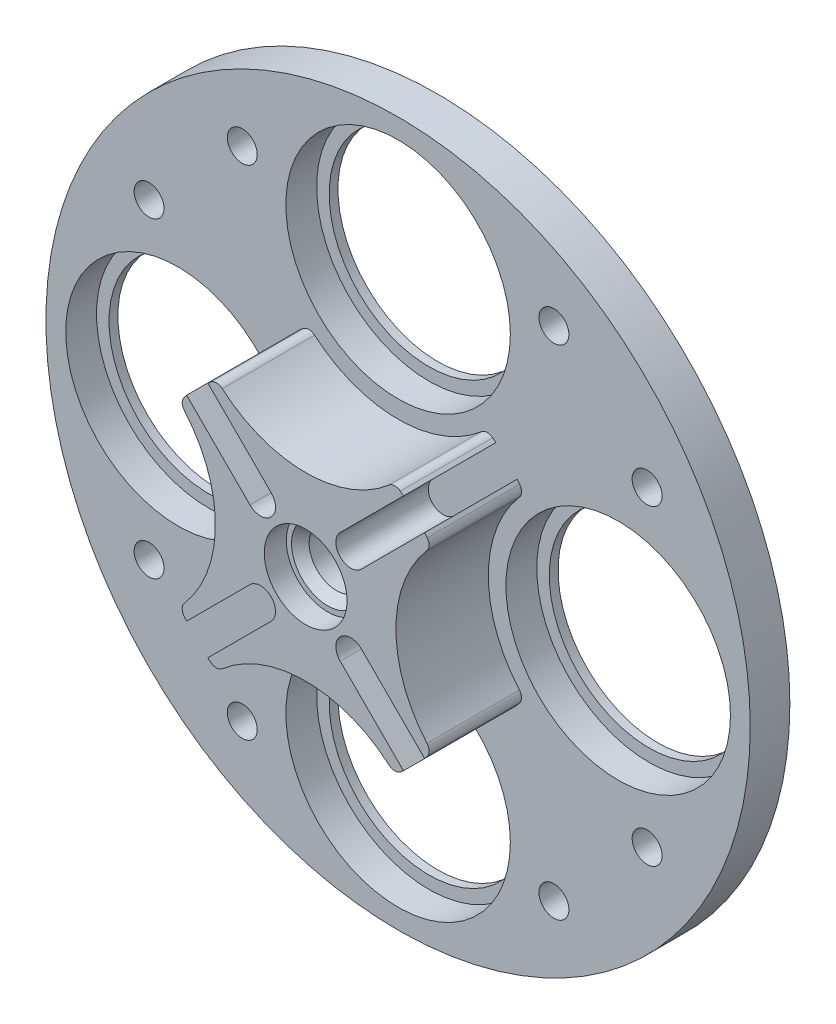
SolidWorks part; units mm, degrees
ref_plane "Front Plane" through (0, 0, 0) normal (0, 0, 1) x (1, 0, 0)
ref_plane "Top Plane" through (0, 0, 0) normal (0, 1, 0) x (1, 0, 0)
ref_plane "Right Plane" through (0, 0, 0) normal (1, 0, 0) x (0, 0, -1)
sketch "Sketch2" plane through (0, 0, 0) normal (0, 0, 1) x (1, 0, 0)
  line L0 (0, 0) -> (-28.2843, 28.2843) construction
  line L1 (0, 0) -> (-40, 0) construction
  circle A0 centre (0, 0) radius 40
  circle A1 centre (0, 25) radius 11.33
  circle A2 centre (25, 0) radius 11.33
  circle A3 centre (0, -25) radius 11.33
  circle A4 centre (-25, 0) radius 11.33
  circle A5 centre (0, 0) radius 3.1
  circle A6 centre (17.6978, 28.2843) radius 1.7
  circle A7 centre (-17.6978, 28.2843) radius 1.7
  circle A8 centre (28.2843, -17.6978) radius 1.7
  circle A9 centre (28.2843, 17.6978) radius 1.7
  circle A10 centre (-17.6978, -28.2843) radius 1.7
  circle A11 centre (17.6978, -28.2843) radius 1.7
  circle A12 centre (-28.2843, 17.6978) radius 1.7
  circle A13 centre (-28.2843, -17.6978) radius 1.7
  arc A14 (17.6978, 28.2843) -> (-16.0668, 33.1153) centre (0, 25) cw construction
  point P14 (0, 0)
  point P34 (0, 0)
  dimension "D2" = 22.66
  dimension "D4" = 80
  dimension "D5" = 6.2
  dimension "D6" = 3.4
  dimension "D8" = 18
  dimension "D3" = 25
  dimension "D7" = 45
  dimension "D1" = 4
  dimension "D10" = 4
extrude "Boss-Extrude1" add sketch "Sketch2" along normal blind 1
sketch "Sketch3" plane through (0, 0, 1) normal (0, 0, 1) x (1, 0, 0)
  circle A0 centre (0, 0) radius 40
  circle A1 centre (0, 25) radius 12.75
  circle A3 centre (25, 0) radius 12.75
  circle A4 centre (0, -25) radius 12.75
  circle A5 centre (-25, 0) radius 12.75
  circle A6 centre (0, 0) radius 40 construction
  circle A7 centre (0, 0) radius 3.1
  circle A8 centre (0, 0) radius 3.1 construction
  circle A9 centre (17.6978, 28.2843) radius 1.7
  circle A10 centre (-17.6978, 28.2843) radius 1.7
  circle A11 centre (-17.6978, 28.2843) radius 1.7 construction
  circle A12 centre (17.6978, 28.2843) radius 1.7 construction
  circle A13 centre (28.2843, -17.6978) radius 1.7
  circle A14 centre (28.2843, 17.6978) radius 1.7
  circle A15 centre (-17.6978, -28.2843) radius 1.7
  circle A16 centre (17.6978, -28.2843) radius 1.7
  circle A17 centre (-28.2843, 17.6978) radius 1.7
  circle A18 centre (-28.2843, -17.6978) radius 1.7
  point P17 (0, 0)
  point P45 (0, 0)
  dimension "D1" = 25.5
  dimension "D2" = 4
  dimension "D3" = 4
extrude "Boss-Extrude2" add sketch "Sketch3" along normal blind 3.5
sketch "Helper lines" plane through (0, 0, 4.5) normal (0, 0, 1) x (1, 0, 0)
  line L0 (0, 0) -> (12.3744, 12.3744) construction
  line L1 (12.3744, 12.3744) -> (24.7487, 0) construction
  line L2 (0, 0) -> (24.7487, 0) construction
  line L3 (11.8794, 14.2836) -> (3.9235, 6.3277) construction
  line L4 (5.1256, 5.1256) -> (3.9235, 6.3277) construction
  line L5 (14.2836, 11.8794) -> (6.3277, 3.9235) construction
  line L6 (11.8794, 14.2836) -> (14.2836, 11.8794) construction
  line L7 (10.2487, 0) -> (10.2487, 14.5) construction
  circle A0 centre (24.7487, 0) radius 14.5 construction
  circle A1 centre (0, 0) radius 17.5 construction
  circle A2 centre (24.7487, 0) radius 17.5 construction
  arc A3 (3.9235, 6.3277) -> (6.3277, 3.9235) centre (5.1256, 5.1256) ccw construction
  circle A4 centre (0, 0) radius 7.2487 construction
  arc A5 (10.2574, -0.4999) -> (25.2487, 14.4914) centre (10.2487, 14.5) ccw construction
  point P12 (7.2487, 0)
  point P14 (10.2487, 0)
  dimension "D2" = 29
  dimension "D5" = 1
  dimension "D1" = 17.5
  dimension "D3" = 45
  dimension "D4" = 1.7
  dimension "D6" = 0.5
sketch "Sketch4" plane through (0, 0, 4.5) normal (0, 0, 1) x (1, 0, 0)
  line L0 (11.1138, 13.5179) -> (3.9235, 6.3277)
  line L2 (0, 0) -> (13.0815, 13.0815) construction
  line L3 (11.8794, 14.2836) -> (14.2836, 11.8794) construction
  line L4 (13.5179, 11.1138) -> (6.3277, 3.9235)
  line L5 (11.8794, 14.2836) -> (3.9235, 6.3277) construction
  line L6 (14.2836, 11.8794) -> (6.3277, 3.9235) construction
  line L7 (13.5179, -11.1138) -> (6.3277, -3.9235)
  line L8 (11.1138, -13.5179) -> (3.9235, -6.3277)
  line L9 (-11.1138, -13.5179) -> (-3.9235, -6.3277)
  line L10 (-13.5179, -11.1138) -> (-6.3277, -3.9235)
  line L11 (-13.5179, 11.1138) -> (-6.3277, 3.9235)
  line L12 (-11.1138, 13.5179) -> (-3.9235, 6.3277)
  arc A0 (11.1138, 13.5179) -> (10.0679, 14.3139) centre (0, 0) ccw
  circle A1 centre (0, 0) radius 17.5 construction
  arc A2 (3.9235, 6.3277) -> (6.3277, 3.9235) centre (5.1256, 5.1256) ccw
  arc A3 (14.3139, 10.0679) -> (14.3139, -10.0679) centre (24.7487, 0) ccw
  circle A4 centre (24.7487, 0) radius 14.5 construction
  arc A5 (14.3139, 10.0679) -> (13.5179, 11.1138) centre (0, 0) ccw
  arc A6 (6.3277, -3.9235) -> (3.9235, -6.3277) centre (5.1256, -5.1256) ccw
  arc A7 (10.0679, -14.3139) -> (-10.0679, -14.3139) centre (0, -24.7487) ccw
  arc A8 (-3.9235, -6.3277) -> (-6.3277, -3.9235) centre (-5.1256, -5.1256) ccw
  arc A9 (-14.3139, -10.0679) -> (-14.3139, 10.0679) centre (-24.7487, 0) ccw
  arc A10 (-6.3277, 3.9235) -> (-3.9235, 6.3277) centre (-5.1256, 5.1256) ccw
  arc A11 (-10.0679, 14.3139) -> (10.0679, 14.3139) centre (0, 24.7487) ccw
  arc A12 (-10.0679, 14.3139) -> (-11.1138, 13.5179) centre (0, 0) ccw
  arc A13 (-13.5179, 11.1138) -> (-14.3139, 10.0679) centre (0, 0) ccw
  arc A14 (-11.1138, -13.5179) -> (-10.0679, -14.3139) centre (0, 0) ccw
  arc A15 (-14.3139, -10.0679) -> (-13.5179, -11.1138) centre (0, 0) ccw
  arc A16 (10.0679, -14.3139) -> (11.1138, -13.5179) centre (0, 0) ccw
  arc A17 (13.5179, -11.1138) -> (14.3139, -10.0679) centre (0, 0) ccw
  circle A18 centre (0, 0) radius 3.1
  circle A19 centre (0, 0) radius 3.1 construction
  point P52 (0, 0)
  dimension "D1" = 4
extrude "Boss-Extrude3" add sketch "Sketch4" along normal blind 10.5
sketch "Sketch6" plane through (0, 0, 15) normal (0, 0, 1) x (1, 0, 0)
  circle A0 centre (0, 0) radius 4.7
  dimension "D1" = 9.4
extrude "Cut-Extrude2" cut sketch "Sketch6" against normal blind 2.5
chamfer "Chamfer1" distance 1 angle 45 1 edges at (3.1, 0, 12.5)
sketch "Sketch5" plane through (0, 0, 0) normal (0, 0, -1) x (-1, 0, 0)
  line L0 (29.9297, 14.8478) -> (31.5752, 17.6978)
  line L1 (-14.8478, 29.9297) -> (-17.6978, 31.5752)
  line L2 (-17.6978, 31.5752) -> (-20.5478, 29.9297)
  line L3 (-20.5478, 29.9297) -> (-20.5478, 26.6388)
  line L4 (-20.5478, 26.6388) -> (-17.6978, 24.9934)
  line L5 (-17.6978, 24.9934) -> (-14.8478, 26.6388)
  line L6 (-14.8478, 26.6388) -> (-14.8478, 29.9297)
  line L7 (20.5478, 26.6388) -> (20.5478, 29.9297)
  line L8 (20.5478, 29.9297) -> (17.6978, 31.5752)
  line L9 (17.6978, 31.5752) -> (14.8478, 29.9297)
  line L10 (14.8478, 29.9297) -> (14.8478, 26.6388)
  line L11 (14.8478, 26.6388) -> (17.6978, 24.9934)
  line L12 (17.6978, 24.9934) -> (20.5478, 26.6388)
  line L13 (31.5752, 17.6978) -> (29.9297, 20.5478)
  line L14 (29.9297, 20.5478) -> (26.6388, 20.5478)
  line L15 (26.6388, 20.5478) -> (24.9934, 17.6978)
  line L16 (24.9934, 17.6978) -> (26.6388, 14.8478)
  line L17 (26.6388, 14.8478) -> (29.9297, 14.8478)
  line L18 (26.6388, -20.5478) -> (29.9297, -20.5478)
  line L19 (29.9297, -20.5478) -> (31.5752, -17.6978)
  line L20 (31.5752, -17.6978) -> (29.9297, -14.8478)
  line L21 (29.9297, -14.8478) -> (26.6388, -14.8478)
  line L22 (26.6388, -14.8478) -> (24.9934, -17.6978)
  line L23 (24.9934, -17.6978) -> (26.6388, -20.5478)
  line L24 (14.8478, -29.9297) -> (17.6978, -31.5752)
  line L25 (17.6978, -31.5752) -> (20.5478, -29.9297)
  line L26 (20.5478, -29.9297) -> (20.5478, -26.6388)
  line L27 (20.5478, -26.6388) -> (17.6978, -24.9934)
  line L28 (17.6978, -24.9934) -> (14.8478, -26.6388)
  line L29 (14.8478, -26.6388) -> (14.8478, -29.9297)
  line L30 (-20.5478, -26.6388) -> (-20.5478, -29.9297)
  line L31 (-20.5478, -29.9297) -> (-17.6978, -31.5752)
  line L32 (-17.6978, -31.5752) -> (-14.8478, -29.9297)
  line L33 (-14.8478, -29.9297) -> (-14.8478, -26.6388)
  line L34 (-14.8478, -26.6388) -> (-17.6978, -24.9934)
  line L35 (-17.6978, -24.9934) -> (-20.5478, -26.6388)
  line L36 (-29.9297, -14.8478) -> (-31.5752, -17.6978)
  line L37 (-31.5752, -17.6978) -> (-29.9297, -20.5478)
  line L38 (-29.9297, -20.5478) -> (-26.6388, -20.5478)
  line L39 (-26.6388, -20.5478) -> (-24.9934, -17.6978)
  line L40 (-24.9934, -17.6978) -> (-26.6388, -14.8478)
  line L41 (-26.6388, -14.8478) -> (-29.9297, -14.8478)
  line L42 (-26.6388, 20.5478) -> (-29.9297, 20.5478)
  line L43 (-29.9297, 20.5478) -> (-31.5752, 17.6978)
  line L44 (-31.5752, 17.6978) -> (-29.9297, 14.8478)
  line L45 (-29.9297, 14.8478) -> (-26.6388, 14.8478)
  line L46 (-26.6388, 14.8478) -> (-24.9934, 17.6978)
  line L47 (-24.9934, 17.6978) -> (-26.6388, 20.5478)
  circle A0 centre (-17.6978, 28.2843) radius 2.85 construction
  circle A1 centre (17.6978, 28.2843) radius 2.85 construction
  point P57 (0, 0)
  dimension "D1" = 5.7
  dimension "D2" = 4
extrude "Cut-Extrude1" cut sketch "Sketch5" against normal blind 2.1
fillet "Fillet1" radius 1 8 edges at (10.0679, 14.3139, 9.75) (-10.0679, 14.3139, 9.75) (-14.3139, 10.0679, 9.75) (-14.3139, -10.0679, 9.75) (-10.0679, -14.3139, 9.75) (10.0679, -14.3139, 9.75) (14.3139, -10.0679, 9.75) (14.3139, 10.0679, 9.75)
